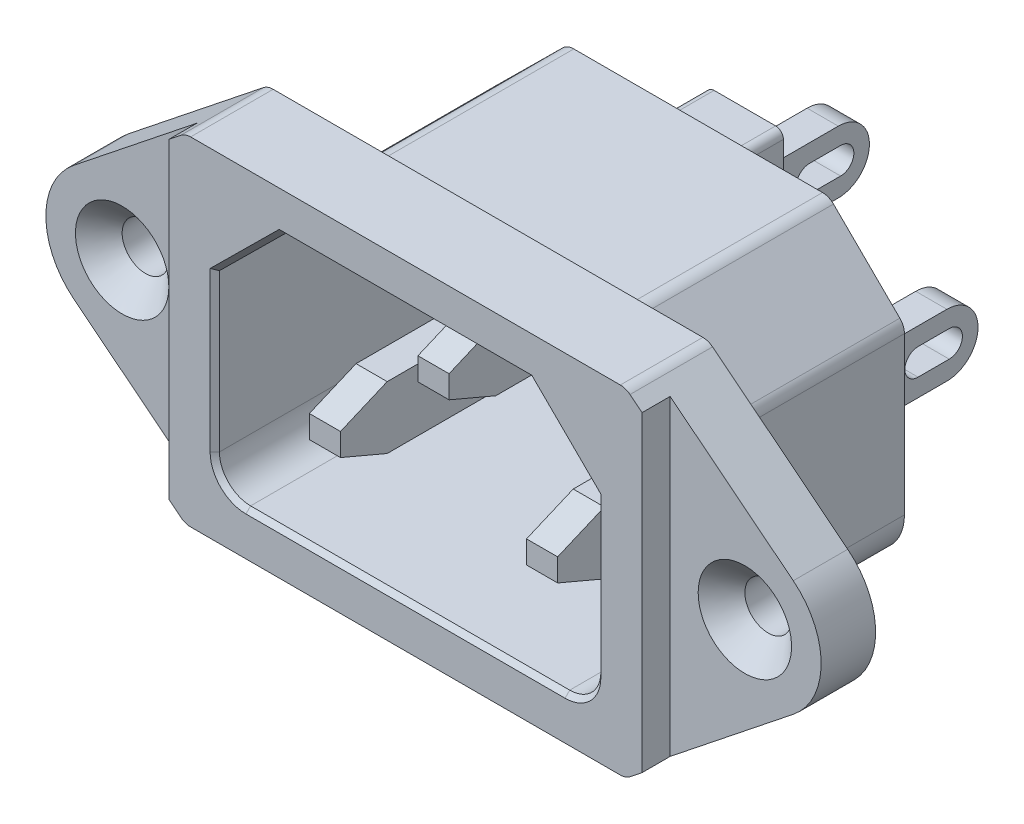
SolidWorks part; units mm, degrees
ref_plane "Front Plane" through (0, 0, 0) normal (0, 0, 1) x (1, 0, 0)
ref_plane "Top Plane" through (0, 0, 0) normal (0, 1, 0) x (1, 0, 0)
ref_plane "Right Plane" through (0, 0, 0) normal (1, 0, 0) x (0, 0, -1)
sketch "Sketch1" plane through (0, 0, 0) normal (0, 0, 1) x (1, 0, 0)
  line L0 (1.791, 3.7158) -> (10.4766, 10.6323)
  line L1 (11.0995, 10.85) -> (38.7005, 10.85)
  line L2 (39.3234, 10.6323) -> (48.009, 3.7158)
  line L3 (48.009, -3.7158) -> (39.3234, -10.6323)
  line L4 (38.7005, -10.85) -> (11.0995, -10.85)
  line L5 (10.4766, -10.6323) -> (1.791, -3.7158)
  line L6 (4.75, 0) -> (45.05, 0) construction
  line L7 (24.9, 10.85) -> (24.9, -10.85) construction
  arc A0 (48.009, 3.7158) -> (48.009, -3.7158) centre (45.05, 0) cw
  arc A1 (1.791, 3.7158) -> (1.791, -3.7158) centre (4.75, 0) ccw
  arc A2 (11.0995, -10.85) -> (10.4766, -10.6323) centre (11.0995, -9.85) cw
  arc A3 (39.3234, -10.6323) -> (38.7005, -10.85) centre (38.7005, -9.85) cw
  arc A4 (38.7005, 10.85) -> (39.3234, 10.6323) centre (38.7005, 9.85) cw
  arc A5 (10.4766, 10.6323) -> (11.0995, 10.85) centre (11.0995, 9.85) cw
  circle A6 centre (4.9, 0) radius 1.5
  circle A7 centre (44.9, 0) radius 1.5
  point P12 (0, 0)
  point P13 (49.8, 0)
  point P21 (39.05, 10.85)
  point P24 (10.75, 10.85)
  point P29 (0, 0)
  point P30 (0, 0)
  dimension "D1" = 4.75
  dimension "D5" = 1
  dimension "D6" = 40
  dimension "D7" = 3
  dimension "D2" = 49.8
  dimension "D3" = 21.7
  dimension "D4" = 28.3
extrude "Boss-Extrude1" add sketch "Sketch1" along normal blind 21.8
sketch "Sketch2" plane through (0, 0, 21.8) normal (0, 0, 1) x (1, 0, 0)
  line L0 (11.0995, -10.85) -> (38.7005, -10.85) construction
  line L1 (11.0995, -10.85) -> (38.7005, -10.85)
  line L2 (9.7, -10.0139) -> (9.7, 10.0139)
  line L3 (11.0995, 10.85) -> (38.7005, 10.85)
  line L4 (40.1, -10.0139) -> (40.1, 10.0139)
  line L6 (24.9, -10.85) -> (24.9, -2.6264) construction
  line L7 (48.009, 3.7158) -> (39.3234, 10.6323) construction
  line L8 (39.3234, -10.6323) -> (48.009, -3.7158) construction
  line L9 (1.791, -3.7158) -> (10.4766, -10.6323) construction
  line L10 (10.4766, 10.6323) -> (1.791, 3.7158) construction
  line L11 (40.1, 10.0139) -> (39.3234, 10.6323)
  line L12 (39.3234, -10.6323) -> (40.1, -10.0139)
  line L13 (9.7, -10.0139) -> (10.4766, -10.6323)
  line L14 (10.4766, 10.6323) -> (9.7, 10.0139)
  line L16 (-4.1169, -19.3982) -> (50.7137, -19.3982)
  line L17 (-4.1169, -19.3982) -> (-4.1169, 12.7876)
  line L18 (-4.1169, 12.7876) -> (50.7137, 12.7876)
  line L19 (50.7137, -19.3982) -> (50.7137, 12.7876)
  arc A0 (39.3234, 10.6323) -> (38.7005, 10.85) centre (38.7005, 9.85) ccw construction
  arc A1 (38.7005, -10.85) -> (39.3234, -10.6323) centre (38.7005, -9.85) ccw construction
  arc A2 (10.4766, -10.6323) -> (11.0995, -10.85) centre (11.0995, -9.85) ccw construction
  arc A3 (11.0995, 10.85) -> (10.4766, 10.6323) centre (11.0995, 9.85) ccw construction
  arc A4 (39.3234, 10.6323) -> (38.7005, 10.85) centre (38.7005, 9.85) ccw
  arc A5 (38.7005, -10.85) -> (39.3234, -10.6323) centre (38.7005, -9.85) ccw
  arc A6 (10.4766, -10.6323) -> (11.0995, -10.85) centre (11.0995, -9.85) ccw
  arc A7 (11.0995, 10.85) -> (10.4766, 10.6323) centre (11.0995, 9.85) ccw
extrude "Cut-Extrude1" cut sketch "Sketch2" against normal blind 1.8
sketch "Sketch3" plane through (0, 0, 0) normal (0, 0, -1) x (-1, 0, 0)
  line L0 (-38.15, -9.05) -> (-38.15, 4.45)
  line L1 (-38.15, 4.45) -> (-33.3, 9.25)
  line L2 (-33.3, 9.25) -> (-16.5, 9.25)
  line L3 (-16.5, 9.25) -> (-11.65, 4.45)
  line L4 (-11.65, 4.45) -> (-11.65, -9.05)
  line L5 (-11.65, -9.05) -> (-38.15, -9.05)
  line L6 (-11.0995, -10.85) -> (-38.7005, -10.85) construction
  line L7 (-24.9, 9.25) -> (-24.9, -9.05) construction
  line L9 (-53.6764, -18.0994) -> (4.0477, -18.0994)
  line L10 (-53.6764, -18.0994) -> (-53.6764, 14.6166)
  line L11 (-53.6764, 14.6166) -> (4.0477, 14.6166)
  line L12 (4.0477, -18.0994) -> (4.0477, 14.6166)
  point P2 (-24.9, -10.85)
  point P7 (-24.9, -9.05)
  dimension "D1" = 26.5
  dimension "D2" = 18.3
  dimension "D3" = 1.8
  dimension "D4" = 16.8
  dimension "D5" = 13.5
extrude "Cut-Extrude2" cut sketch "Sketch3" against normal blind 16.5
fillet "Fillet1" radius 3 2 edges at (11.65, -9.05, 8.25) (38.15, -9.05, 8.25)
fillet "Fillet2" radius 1 4 edges at (38.15, 4.45, 8.25) (33.3, 9.25, 8.25) (16.5, 9.25, 8.25) (11.65, 4.45, 8.25)
sketch "Sketch4" plane through (0, 0, 21.8) normal (0, 0, 1) x (1, 0, 0)
  line L12 (37.15, 4.0327) -> (32.8888, 8.25)
  line L13 (37.15, -6.05) -> (37.15, 4.0327)
  line L14 (14.65, -8.05) -> (35.15, -8.05)
  line L15 (12.65, 4.0327) -> (12.65, -6.05)
  line L16 (16.9112, 8.25) -> (12.65, 4.0327)
  line L17 (32.8888, 8.25) -> (16.9112, 8.25)
  line L18 (37.15, 4.0327) -> (32.8888, 8.25)
  line L19 (37.15, -6.05) -> (37.15, 4.0327)
  line L20 (14.65, -8.05) -> (35.15, -8.05)
  line L21 (12.65, 4.0327) -> (12.65, -6.05)
  line L22 (16.9112, 8.25) -> (12.65, 4.0327)
  line L23 (32.8888, 8.25) -> (16.9112, 8.25)
  arc A12 (35.15, -8.05) -> (37.15, -6.05) centre (35.15, -6.05) ccw
  arc A13 (12.65, -6.05) -> (14.65, -8.05) centre (14.65, -6.05) ccw
  arc A14 (35.15, -8.05) -> (37.15, -6.05) centre (35.15, -6.05) ccw
  arc A15 (12.65, -6.05) -> (14.65, -8.05) centre (14.65, -6.05) ccw
  dimension "D1" = 1
extrude "Cut-Extrude3" cut sketch "Sketch4" against normal blind 17.8
chamfer "Chamfer1" distance 0.3 angle 45 8 edges at (37.15, -1.0086, 21.8) (36.5642, -7.4642, 21.8) (24.9, -8.05, 21.8) (13.2358, -7.4642, 21.8) (35.0194, 6.1414, 21.8) (12.65, -1.0086, 21.8) (14.7806, 6.1414, 21.8) (24.9, 8.25, 21.8)
chamfer "Chamfer2" distance 1.5 angle 45 2 edges at (3.4, 0, 20) (43.4, 0, 20)
sketch "Sketch5" plane through (0, 0, 0) normal (0, 0, -1) x (-1, 0, 0)
  line L1 (-26.875, -1.55) -> (-22.925, -1.55)
  line L2 (-27.375, -1.05) -> (-27.375, 7.95)
  line L3 (-26.875, 8.45) -> (-22.925, 8.45)
  line L4 (-22.425, -1.05) -> (-22.425, 7.95)
  line L5 (-19.9, -8.25) -> (-15.95, -8.25)
  line L6 (-20.4, -7.75) -> (-20.4, 1.25)
  line L7 (-19.9, 1.75) -> (-15.95, 1.75)
  line L8 (-15.45, -7.75) -> (-15.45, 1.25)
  line L9 (-33.85, -8.25) -> (-29.9, -8.25)
  line L10 (-34.35, -7.75) -> (-34.35, 1.25)
  line L11 (-33.85, 1.75) -> (-29.9, 1.75)
  line L12 (-29.4, -7.75) -> (-29.4, 1.25)
  line L14 (-35.15, -9.05) -> (-14.65, -9.05) construction
  line L15 (-16.9112, 9.25) -> (-32.8888, 9.25) construction
  line L16 (-40.7756, -11.3531) -> (-7.6971, -11.3531)
  line L17 (-40.7756, -11.3531) -> (-40.7756, 11.239)
  line L18 (-40.7756, 11.239) -> (-7.6971, 11.239)
  line L19 (-7.6971, -11.3531) -> (-7.6971, 11.239)
  arc A0 (-29.9, -8.25) -> (-29.4, -7.75) centre (-29.9, -7.75) ccw
  arc A1 (-34.35, 1.25) -> (-33.85, 1.75) centre (-33.85, 1.25) cw
  arc A2 (-29.9, 1.75) -> (-29.4, 1.25) centre (-29.9, 1.25) cw
  arc A3 (-33.85, -8.25) -> (-34.35, -7.75) centre (-33.85, -7.75) cw
  arc A4 (-15.95, -8.25) -> (-15.45, -7.75) centre (-15.95, -7.75) ccw
  arc A5 (-20.4, 1.25) -> (-19.9, 1.75) centre (-19.9, 1.25) cw
  arc A6 (-15.95, 1.75) -> (-15.45, 1.25) centre (-15.95, 1.25) cw
  arc A7 (-19.9, -8.25) -> (-20.4, -7.75) centre (-19.9, -7.75) cw
  arc A8 (-22.925, -1.55) -> (-22.425, -1.05) centre (-22.925, -1.05) ccw
  arc A9 (-27.375, 7.95) -> (-26.875, 8.45) centre (-26.875, 7.95) cw
  arc A10 (-22.925, 8.45) -> (-22.425, 7.95) centre (-22.925, 7.95) cw
  arc A11 (-26.875, -1.55) -> (-27.375, -1.05) centre (-26.875, -1.05) cw
  point P36 (-22.425, -1.55)
  point P39 (-27.375, 8.45)
  point P42 (-22.425, 8.45)
  dimension "D6" = 0.5
  dimension "D1" = 10
  dimension "D2" = 4.95
  dimension "D3" = 0.8
  dimension "D4" = 0.8
  dimension "D5" = 9
extrude "Cut-Extrude4" cut sketch "Sketch5" against normal blind 3
sketch "Sketch6" plane through (0, 0, 20) normal (0, 0, 1) x (1, 0, 0)
  line L1 (23.9, 1.45) -> (25.9, 1.45)
  line L2 (23.9, 1.45) -> (23.9, 5.45)
  line L3 (23.9, 5.45) -> (25.9, 5.45)
  line L4 (25.9, 1.45) -> (25.9, 5.45)
  line L5 (16.925, -5.25) -> (18.925, -5.25)
  line L6 (16.925, -5.25) -> (16.925, -1.25)
  line L7 (16.925, -1.25) -> (18.925, -1.25)
  line L8 (18.925, -5.25) -> (18.925, -1.25)
  line L9 (30.875, -5.25) -> (32.875, -5.25)
  line L10 (30.875, -5.25) -> (30.875, -1.25)
  line L11 (30.875, -1.25) -> (32.875, -1.25)
  line L12 (32.875, -5.25) -> (32.875, -1.25)
  line L13 (27.375, 7.95) -> (27.375, -1.05) construction
  line L14 (26.875, -1.55) -> (22.925, -1.55) construction
  line L15 (20.4, 1.25) -> (20.4, -7.75) construction
  line L16 (15.95, 1.75) -> (19.9, 1.75) construction
  line L17 (29.9, 1.75) -> (33.85, 1.75) construction
  line L18 (34.35, 1.25) -> (34.35, -7.75) construction
  point P12 (24.9, 1.45)
  point P13 (25.9, 3.45)
  point P14 (27.375, 3.45)
  point P15 (24.9, -1.55)
  point P18 (20.4, -3.25)
  point P21 (17.925, 1.75)
  point P22 (18.925, -3.25)
  point P25 (31.875, 1.75)
  point P28 (34.35, -3.25)
  point P31 (32.875, -3.25)
  point P34 (31.875, -1.25)
  point P35 (0, 0)
  point P36 (17.925, -1.25)
  point P37 (0, 0)
  point P38 (0, 0)
  dimension "D1" = 4
  dimension "D2" = 2
extrude "Boss-Extrude2" add sketch "Sketch6" against normal blind 27
chamfer "Chamfer3" distance 3 angle 23 6 edges at (31.875, -5.25, 20) (31.875, -1.25, 20) (17.925, -5.25, 20) (17.925, -1.25, 20) (24.9, 1.45, 20) (24.9, 5.45, 20)
sketch "Sketch7" plane through (25.9, 0, 0) normal (1, 0, 0) x (0, 0, -1)
  line L0 (3.15, 3.45) -> (5.15, 3.45) construction
  line L1 (3.15, 4.3) -> (5.15, 4.3)
  line L2 (3.15, 2.6) -> (5.15, 2.6)
  line L3 (3.15, -3.25) -> (5.15, -3.25) construction
  line L4 (3.15, -2.4) -> (5.15, -2.4)
  line L5 (3.15, -4.1) -> (5.15, -4.1)
  line L6 (7, 1.45) -> (7, 5.45) construction
  line L7 (7, -5.25) -> (7, -1.25) construction
  arc A0 (3.15, 4.3) -> (3.15, 2.6) centre (3.15, 3.45) ccw
  arc A1 (5.15, 2.6) -> (5.15, 4.3) centre (5.15, 3.45) ccw
  arc A2 (3.15, -2.4) -> (3.15, -4.1) centre (3.15, -3.25) ccw
  arc A3 (5.15, -4.1) -> (5.15, -2.4) centre (5.15, -3.25) ccw
  point P2 (4.15, 3.45)
  point P7 (4.15, -3.25)
  point P14 (7, -3.25)
  point P15 (7, 3.45)
  point P16 (6, -3.25)
  point P21 (6, 3.45)
  point P22 (0, 0)
  point P23 (0, 0)
  dimension "D1" = 0.85
  dimension "D2" = 1
  dimension "D3" = 2
extrude "Cut-Extrude5" cut sketch "Sketch7" against normal through all both and the other way through all
fillet "Fillet3" radius 2 6 edges at (31.875, -5.25, -7) (31.875, -1.25, -7) (17.925, -5.25, -7) (24.9, 1.45, -7) (17.925, -1.25, -7) (24.9, 5.45, -7)
